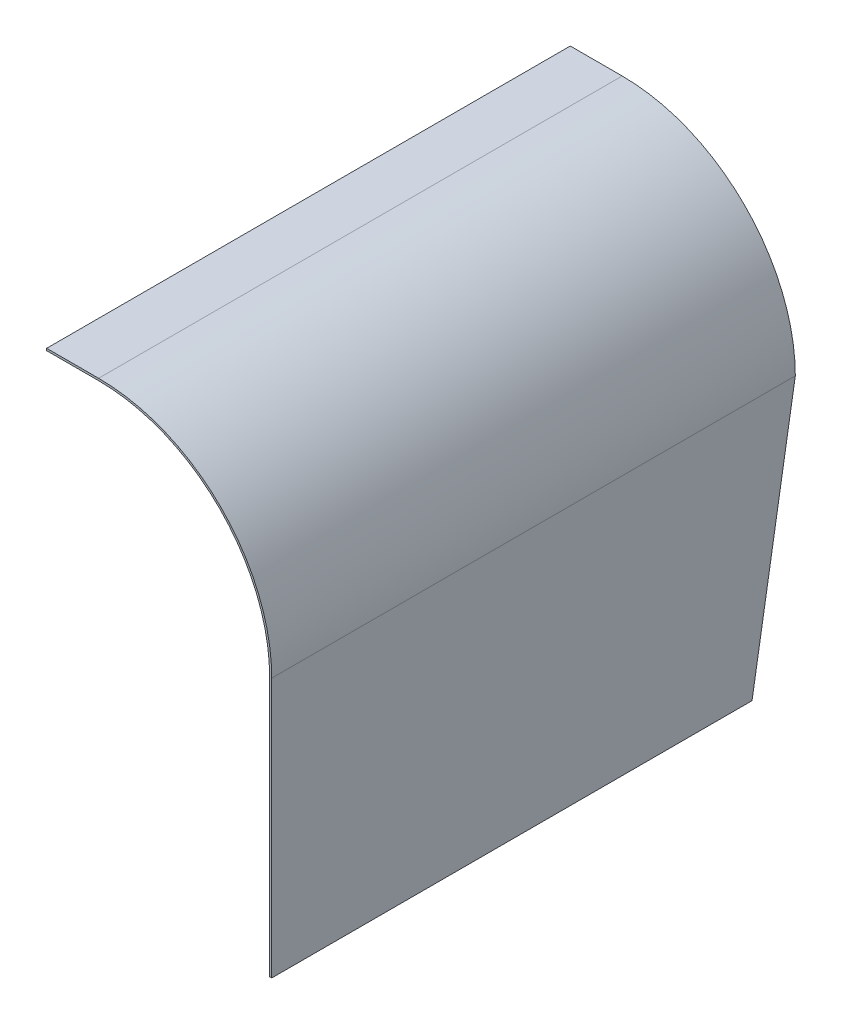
SolidWorks part; units mm, degrees
ref_plane "Front Plane" through (0, 0, 0) normal (0, 0, 1) x (1, 0, 0)
ref_plane "Top Plane" through (0, 0, 0) normal (0, 1, 0) x (1, 0, 0)
ref_plane "Right Plane" through (0, 0, 0) normal (1, 0, 0) x (0, 0, -1)
sketch "Sketch4" plane through (0, 0, 0) normal (0, 0, 1) x (1, 0, 0)
  line L0 (0, 0) -> (30, 0)
  line L1 (130, -100) -> (130, -250)
  arc A0 (30, 0) -> (130, -100) centre (30, -100) cw
  dimension "D2" = 100
  dimension "D1" = 30
  dimension "D3" = 250
extrude "Extrude-Thin1" add sketch "Sketch4" along normal blind 302.428 thin
sketch "Sketch6" plane through (130, 0, 0) normal (1, 0, 0) x (0, 0, -1)
  line L0 (-302.428, -100) -> (-277.428, -250)
  line L1 (-302.428, -250) -> (0, -250) construction
  line L2 (-277.428, -250) -> (-302.428, -250)
  line L3 (-302.428, -250) -> (-302.428, -100)
  dimension "D1" = 25
extrude "Extrude1" [suppressed] cut sketch "Sketch6" against normal blind 10
sketch "Sketch7" [suppressed] plane through (130, 0, 0) normal (1, 0, 0) x (0, 0, -1)
  line L0 (-102.428, -100) -> (-102.428, -130)
  line L1 (-102.428, -130) -> (-77.428, -130)
  line L2 (-102.428, -130) -> (0, -130) construction
  line L3 (-77.428, -130) -> (-102.428, -100)
  dimension "D1" = 25
extrude "Extrude2" [suppressed] cut sketch "Sketch7" against normal blind 10
sketch "Sketch8" plane through (130, 0, 0) normal (1, 0, 0) x (0, 0, -1)
  line L0 (0, -250) -> (0, -100)
  line L1 (0, -100) -> (-25, -250)
  line L2 (-302.428, -250) -> (0, -250) construction
  line L3 (-25, -250) -> (0, -250)
  dimension "D1" = 25
extrude "Extrude3" cut sketch "Sketch8" against normal blind 10
